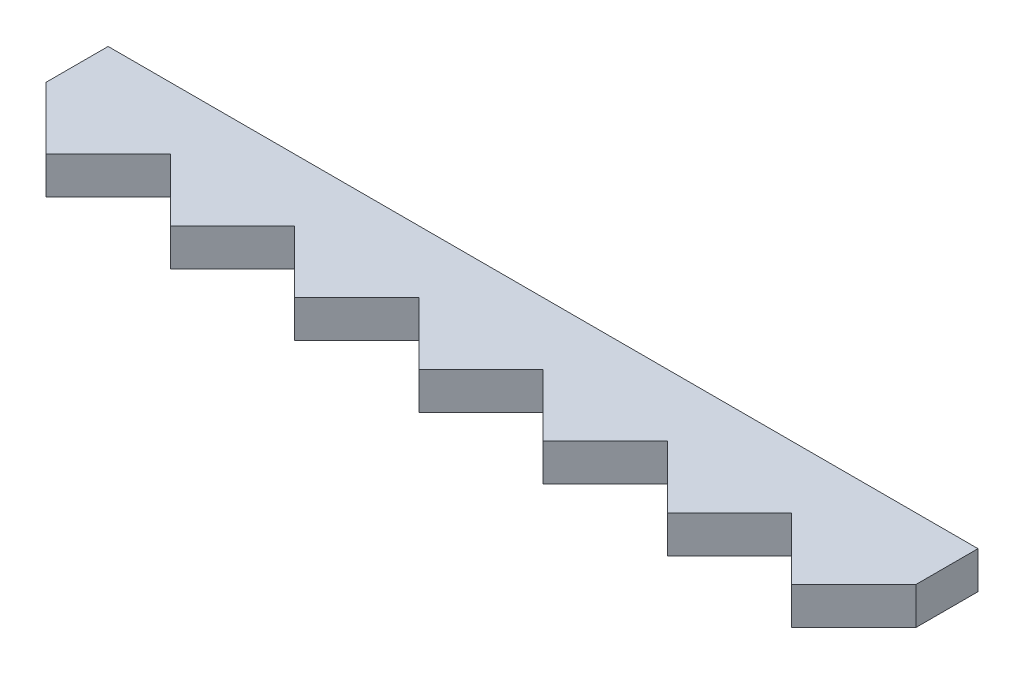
SolidWorks part; units mm, degrees
ref_plane "Front Plane" through (0, 0, 0) normal (0, 0, 1) x (1, 0, 0)
ref_plane "Top Plane" through (0, 0, 0) normal (0, 1, 0) x (1, 0, 0)
ref_plane "Right Plane" through (0, 0, 0) normal (1, 0, 0) x (0, 0, -1)
sketch "Sketch1" plane through (0, 3, 0) normal (0, 1, 0) x (1, 0, 0)
  line L0 (0, 32.1404) -> (0, 27.1404)
  line L1 (66, 32.1404) -> (-5, 32.1404) construction
  line L2 (0, 27.1404) -> (5, 22.1404)
  line L3 (5, 22.1404) -> (10, 27.1404)
  line L4 (5, 22.1404) -> (65, 22.1404) construction
  line L5 (0, 27.1404) -> (70, 27.1404) construction
  line L6 (70, 22.1404) -> (70, 46.1404) construction
  line L7 (10, 27.1404) -> (15, 22.1404)
  line L8 (15, 22.1404) -> (20, 27.1404)
  line L9 (20, 27.1404) -> (25, 22.1404)
  line L10 (25, 22.1404) -> (30, 27.1404)
  line L11 (30, 27.1404) -> (35, 22.1404)
  line L12 (35, 22.1404) -> (40, 27.1404)
  line L13 (40, 27.1404) -> (45, 22.1404)
  line L14 (45, 22.1404) -> (50, 27.1404)
  line L15 (50, 27.1404) -> (55, 22.1404)
  line L16 (55, 22.1404) -> (60, 27.1404)
  line L17 (60, 27.1404) -> (65, 22.1404)
  line L18 (65, 22.1404) -> (70, 27.1404)
  line L19 (0, 32.1404) -> (70, 32.1404)
  line L20 (70, 32.1404) -> (70, 27.1404)
  point P7 (65.8168, 22.1404)
  dimension "D1" = 5
  dimension "D2" = 5
  dimension "D3" = 10
  dimension "D4" = 7
extrude "Boss-Extrude1" add sketch "Sketch1" along normal blind 3
